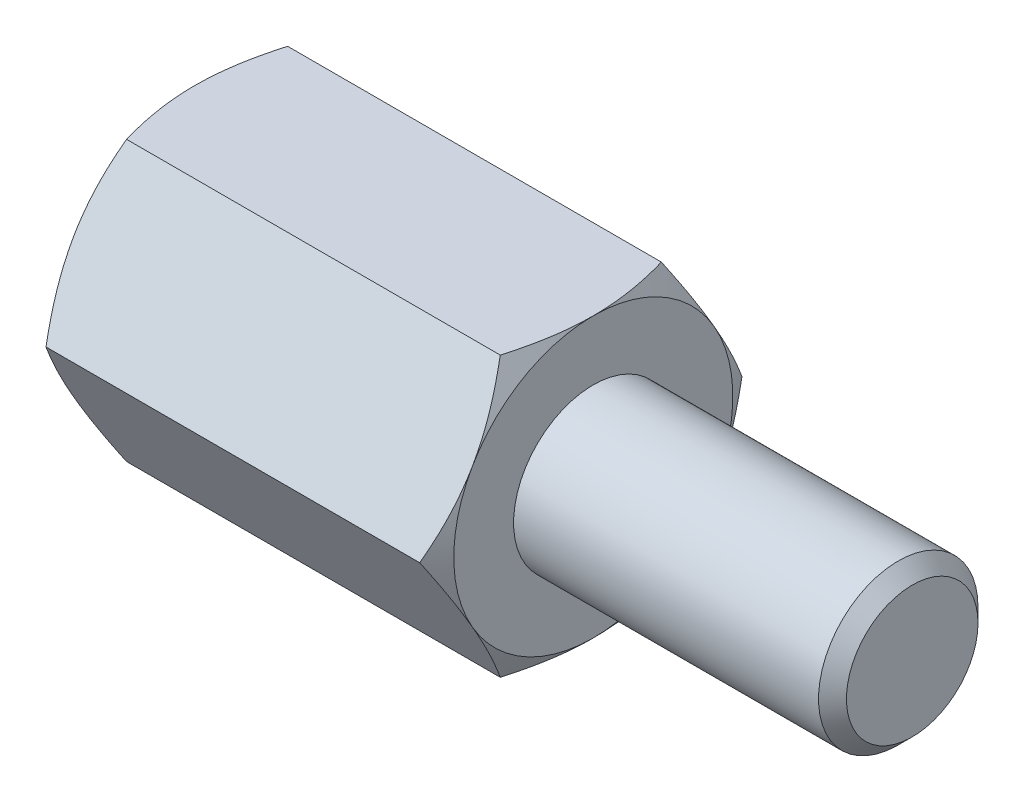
SolidWorks part; units mm, degrees
ref_plane "Front Plane" through (0, 0, 0) normal (0, 0, 1) x (1, 0, 0)
ref_plane "Top Plane" through (0, 0, 0) normal (0, 1, 0) x (1, 0, 0)
ref_plane "Right Plane" through (0, 0, 0) normal (1, 0, 0) x (0, 0, -1)
sketch "Sketch1" plane through (0, 0, 0) normal (1, 0, 0) x (0, 0, -1)
  line L1 (2.0207, 3.5) -> (-2.0207, 3.5)
  line L2 (-2.0207, 3.5) -> (-4.0415, 0)
  line L3 (-4.0415, 0) -> (-2.0207, -3.5)
  line L4 (-2.0207, -3.5) -> (2.0207, -3.5)
  line L5 (2.0207, -3.5) -> (4.0415, 0)
  line L6 (4.0415, 0) -> (2.0207, 3.5)
  circle A0 centre (0, 0) radius 3.5 construction
  dimension "D1" = 7
extrude "Extrude2" add sketch "Sketch1" along normal mid plane 10
sketch "Sketch2" plane through (0, 0, 0) normal (0, 0, 1) x (1, 0, 0)
  line L0 (-5, 3.5) -> (-3.5, 6.0981)
  line L1 (-5, 6.5) -> (-5, 3.5)
  line L3 (0, 0) -> (50000, 0) construction
  arc A0 (-3.5, 6.0981) -> (-5, 6.5) centre (-4.1962, 6.5) ccw
  dimension "D1" = 30
  dimension "D2" = 3
revolve "Cut-Revolve1" cut sketch "Sketch2" angle 360 about L3
mirror "Mirror1" about plane through (0, 0, 0) normal (1, 0, 0) of "Cut-Revolve1"
sketch "Sketch3" plane through (-5, 0, 0) normal (-1, 0, 0) x (0, 0, 1)
  circle A0 centre (0, 0) radius 1.65
  dimension "D1" = 3.3
extrude "Extrude3" cut sketch "Sketch3" against normal blind 5
sketch "Sketch4" plane through (0, 0, 0) normal (0, 0, 1) x (1, 0, 0)
  line L0 (0, 0) -> (0, 1.65)
  line L1 (4.6874, 0) -> (-4.6874, 0) construction
  line L2 (0, 1.65) -> (0.9526, 0)
  line L3 (0.9526, 0) -> (0, 0)
  line L4 (-5, 1.75) -> (-5, -1.75) construction
  point P4 (-5, 0)
  dimension "D1" = 30
  dimension "D2" = 1.65
  dimension "D3" = 5
revolve "Cut-Revolve2" cut sketch "Sketch4" angle 360 about L3
sketch "Sketch5" plane through (5, 0, 0) normal (1, 0, 0) x (0, 0, -1)
  circle A0 centre (0, 0) radius 2
  dimension "D1" = 4
extrude "Extrude4" add sketch "Sketch5" along normal blind 8
chamfer "Chamfer1" distance 0.35 angle 45 1 edges at (13, 0, -2)
equation "\"D2@Sketch4\" = \"D1@Sketch3\"/2"
